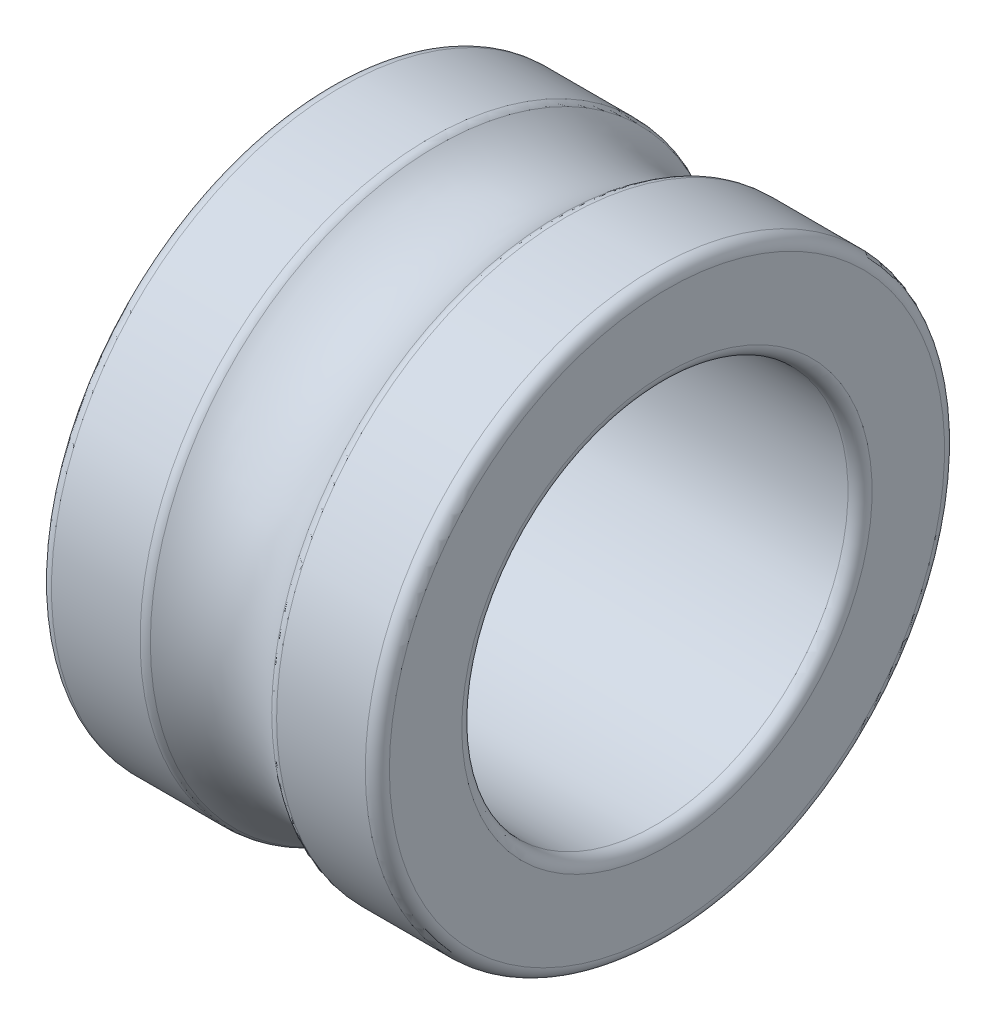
SolidWorks part; units mm, degrees
ref_plane "Face" through (0, 0, 0) normal (0, 0, 1) x (1, 0, 0)
ref_plane "Dessus" through (0, 0, 0) normal (0, 1, 0) x (1, 0, 0)
ref_plane "Droite" through (0, 0, 0) normal (1, 0, 0) x (0, 0, -1)
sketch "Esquisse1" plane through (0, 0, 0) normal (0, 0, 1) x (1, 0, 0)
  line L0 (-31.6677, 0) -> (38.3161, 0) construction
  line L1 (1.3229, 6) -> (3.5, 6)
  line L2 (-3.5, 4) -> (3.5, 4)
  line L3 (-3.5, 4) -> (-3.5, 6)
  line L4 (-3.5, 6) -> (-1.3229, 6)
  line L5 (3.5, 4) -> (3.5, 6)
  arc A0 (-1.3229, 6) -> (1.3229, 6) centre (0, 7.5) ccw
  dimension "D6" = 4
  dimension "D1" = 3.5
  dimension "D2" = 7
  dimension "D3" = 8
  dimension "D4" = 2
  dimension "D5" = 3.5
revolve "Révolution1" add sketch "Esquisse1" angle 360 about L0
fillet "Congé1" radius 0.25
